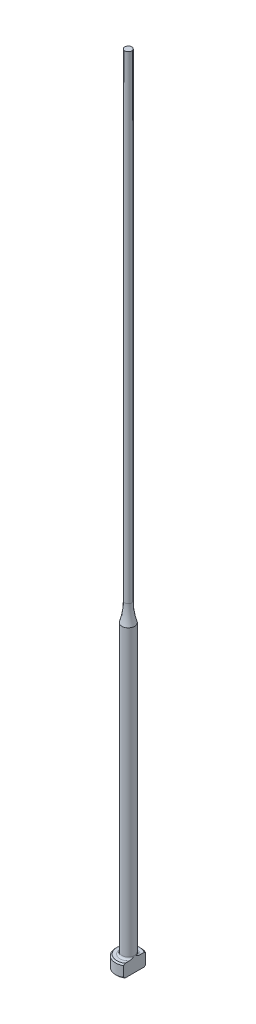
SolidWorks part; units mm, degrees
ref_plane "Front Plane" through (0, 0, 0) normal (0, 0, 1) x (1, 0, 0)
ref_plane "Top Plane" through (0, 0, 0) normal (0, 1, 0) x (1, 0, 0)
ref_plane "Right Plane" through (0, 0, 0) normal (1, 0, 0) x (0, 0, -1)
sketch "Sketch1" plane through (0, 0, 0) normal (0, 0, 1) x (1, 0, 0)
  line L0 (0, 259.9588) -> (0, -15.1925) construction
  line L1 (0, 0) -> (-2, 0)
  line L2 (-2, 0) -> (-2, 2)
  line L3 (-2, 2) -> (-1, 2)
  line L4 (-0.55, 50) -> (-0.55, 125)
  line L5 (-0.55, 125) -> (0, 125)
  line L6 (0, 125) -> (0, 0)
  line L7 (-1, 2) -> (-1, 47.0339)
  arc A0 (-1, 47.0339) -> (-0.55, 50) centre (-10.55, 50) ccw
  point P13 (-1, 0)
  dimension "D1" = 10
  dimension "L" = 125
  dimension "H" = 4
  dimension "T" = 2
  dimension "D" = 1.1
  dimension "B" = 2
  dimension "S" = 50
revolve "Revolve1" add sketch "Sketch1" angle 360 about L0
chamfer "Chamfer1" distance 0.2 angle 45 2 edges at (0, 2, 2) (0, 0, 2)
fillet "Fillet1" radius 0.3 1 edges at (0, 2, 1)
sketch "Sketch2" plane through (0, 0, 0) normal (0, 1, 0) x (1, 0, 0)
  line L0 (1, 1.7321) -> (1, -1.7321)
  circle A0 centre (0, 0) radius 2 construction
  arc A1 (1, -1.7321) -> (1, 1.7321) centre (0, 0) ccw
  circle A2 centre (0, 0) radius 1 construction
extrude "KEY" cut sketch "Sketch2" along normal through all
